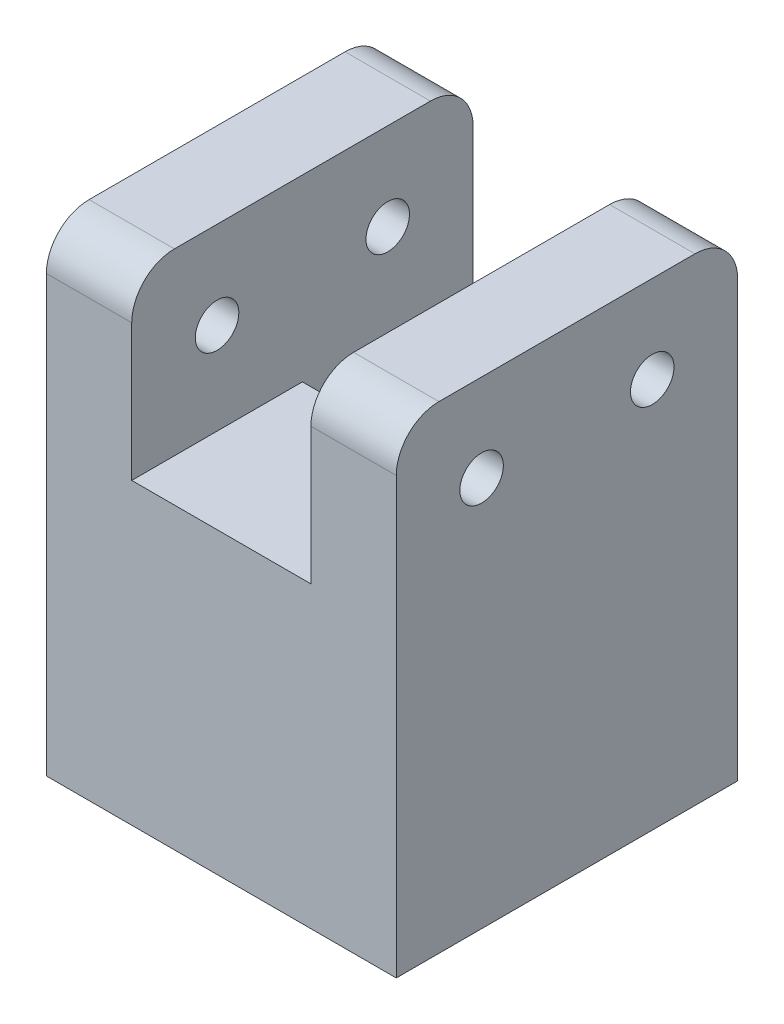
SolidWorks part; units mm, degrees
ref_plane "Front Plane" through (0, 0, 0) normal (0, 0, 1) x (1, 0, 0)
ref_plane "Top Plane" through (0, 0, 0) normal (0, 1, 0) x (1, 0, 0)
ref_plane "Right Plane" through (0, 0, 0) normal (1, 0, 0) x (0, 0, -1)
sketch "Sketch1" plane through (0, 0, 0) normal (0, 0, 1) x (1, 0, 0)
  line L13 (20.5, 20.5) -> (20.5, -0.5)
  line L14 (20.5, -0.5) -> (-0.5, -0.5)
  line L15 (-0.5, -0.5) -> (-0.5, 20.5)
  line L17 (-10.5, 20.5) -> (-10.5, -20.5)
  line L19 (30.5, -20.5) -> (30.5, 20.5)
  line L22 (-10.5, -20.5) -> (-10.5, -35.5)
  line L23 (-10.5, -35.5) -> (30.5, -35.5)
  line L24 (30.5, -35.5) -> (30.5, -20.5)
  line L26 (20.5, 20.5) -> (30.5, 20.5)
  line L28 (-0.5, 20.5) -> (-10.5, 20.5)
extrude "Boss-Extrude1" add sketch "Sketch1" along normal blind 20
sketch "Sketch16" plane through (30.5, 0, 0) normal (1, 0, 0) x (0, 0, -1)
  circle A0 centre (-30, 10.25) radius 2.55
  circle A1 centre (-10, 10.25) radius 2.55
extrude "Cut-Extrude1" cut sketch "Sketch16" against normal through all
sketch "Sketch20" plane through (0, 0, 0) normal (0, 0, -1) x (-1, 0, 0)
  line L5 (-30.5, 20.5) -> (10.5, 20.5)
  line L6 (-30.5, 20.5) -> (-30.5, -35.5)
  line L7 (-30.5, -35.5) -> (10.5, -35.5)
  line L8 (10.5, 20.5) -> (10.5, -35.5)
extrude "Boss-Extrude2" add sketch "Sketch20" along normal blind 20
sketch "Sketch21" plane through (-10.5, 0, 0) normal (-1, 0, 0) x (0, 0, 1)
  circle A2 centre (-10, 10.25) radius 2.55
extrude "Cut-Extrude2" cut sketch "Sketch21" against normal through all contours A2
sketch "Sketch22" plane through (0, 20.5, 0) normal (0, 1, 0) x (1, 0, 0)
  line L0 (-0.5, 0) -> (-0.5, 20)
  line L1 (-10.5, 20) -> (30.5, 20) construction
  line L2 (-0.5, 20) -> (20.5, 20)
  line L3 (20.5, 20) -> (20.5, 0)
  line L4 (20.5, 0) -> (-0.5, 0)
extrude "Cut-Extrude3" cut sketch "Sketch22" against normal through all
sketch "Sketch24" plane through (0, 0, 0) normal (0, 0, -1) x (-1, 0, 0)
  line L0 (0.5, -35.5) -> (0.5, -0.5) construction
  line L1 (-20.5, -35.5) -> (0.5, -35.5)
  line L2 (-20.5, -35.5) -> (-20.5, -25.5)
  line L3 (-20.5, -25.5) -> (0.5, -25.5)
  line L4 (0.5, -35.5) -> (0.5, -25.5)
extrude "Boss-Extrude4" add sketch "Sketch24" along normal through all
fillet "Fillet1" radius 5 5 edges at (10, -25.5, 0) (25.5, 20.5, -20) (25.5, 20.5, 20) (-5.5, 20.5, -20) (-5.5, 20.5, 20)
